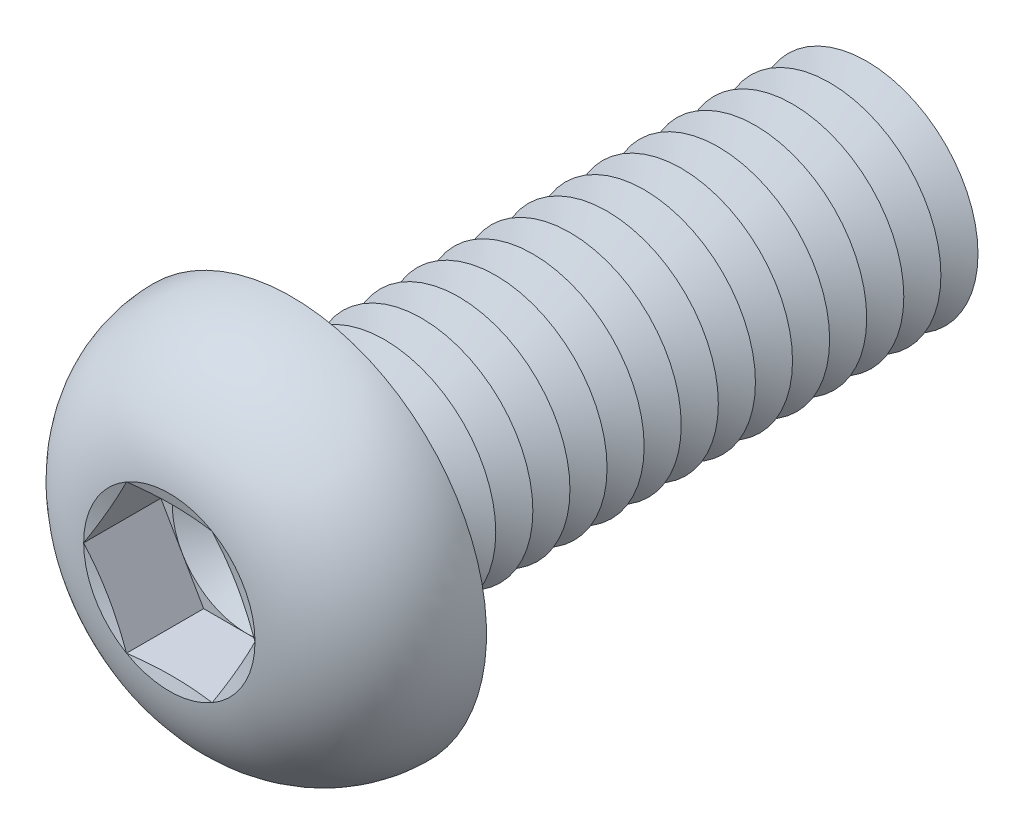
SolidWorks part; units mm, degrees
ref_plane "Front Plane" through (0, 0, 0) normal (0, 0, 1) x (1, 0, 0)
ref_plane "Top Plane" through (0, 0, 0) normal (0, 1, 0) x (1, 0, 0)
ref_plane "Right Plane" through (0, 0, 0) normal (1, 0, 0) x (0, 0, -1)
sketch "Sketch1" plane through (0, 0, 0) normal (1, 0, 0) x (0, 0, -1)
  line L0 (0, 3) -> (0, 5.25)
  line L3 (0, 3) -> (16, 3)
  line L4 (16, 3) -> (16, 0)
  line L5 (16, 0) -> (-3.3, 0) construction
  line L6 (-3.3, 0) -> (16, 0)
  line L7 (-3.3, 2.3094) -> (-3.3, 1.1547) construction
  line L8 (-3.3, 1.1547) -> (-3.3, 0)
  line L9 (-3.3, 2.3094) -> (-2.9906, 1.1547)
  line L10 (-2.9906, 1.1547) -> (-3.3, 1.1547)
  line L11 (16, 0) -> (22.7481, 0) construction
  line L12 (0, 5.25) -> (-3.3, 5.25) construction
  arc A1 (0, 5.25) -> (-3.3, 2.3094) centre (0, 1.928) ccw
  point P8 (16, 1.5)
  dimension "D1" = 10.5
  dimension "D2" = 6
  dimension "D3" = 3.3
  dimension "D4" = 4.6188
  dimension "D5" = 16
  dimension "D6" = 15
revolve "Revolve1" add sketch "Sketch1" angle 360 about L5
fillet "Fillet1" radius 0.5 1 edges at (-3, 0, 0)
sketch "Sketch2" plane through (0, 0, 0) normal (1, 0, 0) x (0, 0, -1)
  line L0 (15.5, 3) -> (16.5, 3)
  line L1 (16, 3) -> (0.5, 3) construction
  line L2 (16.5, 3) -> (16, 2.134)
  line L3 (16, -3) -> (16, 3) construction
  line L4 (16, 2.134) -> (15.5, 3)
  dimension "D1" = 1
revolve "Cut-Revolve1" cut sketch "Sketch2" angle 360 about axis through (0, 0, -16) along (0, 0, -1)
pattern_linear "LPattern1" count 16 spacing 1 along (0, 0, 1) of "Cut-Revolve1"
sketch "Sketch3" plane through (0, 0, 3.3) normal (0, 0, 1) x (1, 0, 0)
  line L7 (1.1547, 2) -> (-1.1547, 2)
  line L8 (-1.1547, 2) -> (-2.3094, 0)
  line L9 (-2.3094, 0) -> (-1.1547, -2)
  line L10 (-1.1547, -2) -> (1.1547, -2)
  line L11 (1.1547, -2) -> (2.3094, 0)
  line L12 (2.3094, 0) -> (1.1547, 2)
  circle A0 centre (0, 0) radius 2 construction
  circle A3 centre (0, 0) radius 2.3094 construction
extrude "Cut-Extrude1" cut sketch "Sketch3" against normal blind 2.08
sketch "Sketch4" plane through (0, 0, 1.22) normal (0, 0, 1) x (1, 0, 0)
  line L1 (1.1547, 2) -> (-1.1547, 2) construction
  circle A0 centre (0, 0) radius 2
extrude "Cut-Extrude2" cut sketch "Sketch4" against normal through all draft 60
